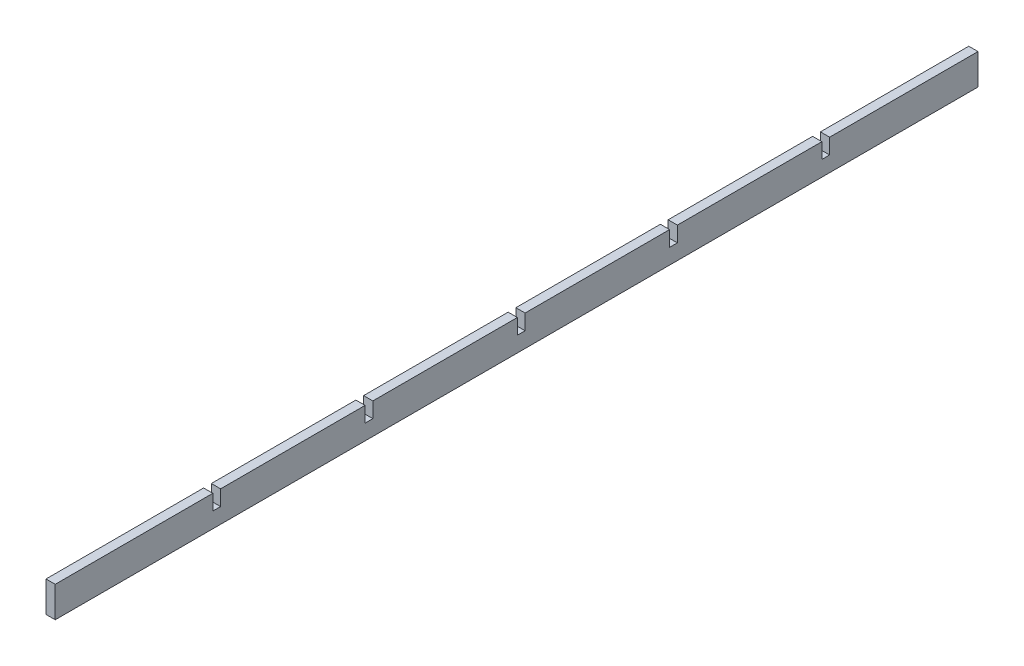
SolidWorks part; units mm, degrees
ref_plane "Alzado" through (0, 0, 0) normal (0, 0, 1) x (1, 0, 0)
ref_plane "Planta" through (0, 0, 0) normal (0, 1, 0) x (1, 0, 0)
ref_plane "Vista lateral" through (0, 0, 0) normal (1, 0, 0) x (0, 0, -1)
sketch "Croquis1" plane through (0, 0, 0) normal (1, 0, 0) x (0, 0, -1)
  line L2 (-148.5, 5) -> (151.5, 5)
  line L3 (-148.5, 5) -> (-148.5, -5)
  line L4 (-148.5, -5) -> (151.5, -5)
  line L5 (151.5, 5) -> (151.5, -5)
extrude "Saliente-Extruir1" add sketch "Croquis1" along normal blind 3
sketch "Croquis2" plane through (3, 0, 0) normal (1, 0, 0) x (0, 0, -1)
  line L0 (151.5, 5) -> (-148.5, 5) construction
  line L1 (100.74, 5) -> (103.26, 5)
  line L2 (100.74, 5) -> (100.74, 0)
  line L3 (100.74, 0) -> (103.26, 0)
  line L4 (103.26, 5) -> (103.26, 0)
  line L5 (151.5, -5) -> (151.5, 5) construction
  line L6 (51.24, 5) -> (51.24, 0)
  line L7 (51.24, 0) -> (53.76, 0)
  line L8 (53.76, 5) -> (53.76, 0)
  line L9 (51.24, 5) -> (53.76, 5)
  line L10 (1.74, 5) -> (1.74, 0)
  line L11 (1.74, 0) -> (4.26, 0)
  line L12 (4.26, 5) -> (4.26, 0)
  line L13 (1.74, 5) -> (4.26, 5)
  line L14 (-47.76, 5) -> (-47.76, 0)
  line L15 (-47.76, 0) -> (-45.24, 0)
  line L16 (-45.24, 5) -> (-45.24, 0)
  line L17 (-47.76, 5) -> (-45.24, 5)
  line L18 (-97.26, 5) -> (-97.26, 0)
  line L19 (-97.26, 0) -> (-94.74, 0)
  line L20 (-94.74, 5) -> (-94.74, 0)
  line L21 (-97.26, 5) -> (-94.74, 5)
  point P6 (102, 5)
extrude "Cortar-Extruir1" cut sketch "Croquis2" against normal blind 10
equation "\"long\"=300"
equation "\"D1@Croquis1\"=\"long\""
equation "\"alt\"=10"
equation "\"D3@Croquis1\"=\"alt\""
equation "\"D4@Croquis1\"= \"alt\" / 2"
equation "\"mat\"=3"
equation "\"D1@Saliente-Extruir1\"=\"mat\""
equation "\"kerf\"= .24"
equation "\"D1@Croquis2\"=\"mat\"-(2*\"kerf\")"
equation "\"leng\"=5"
equation "\"D2@Croquis2\"=\"leng\""
